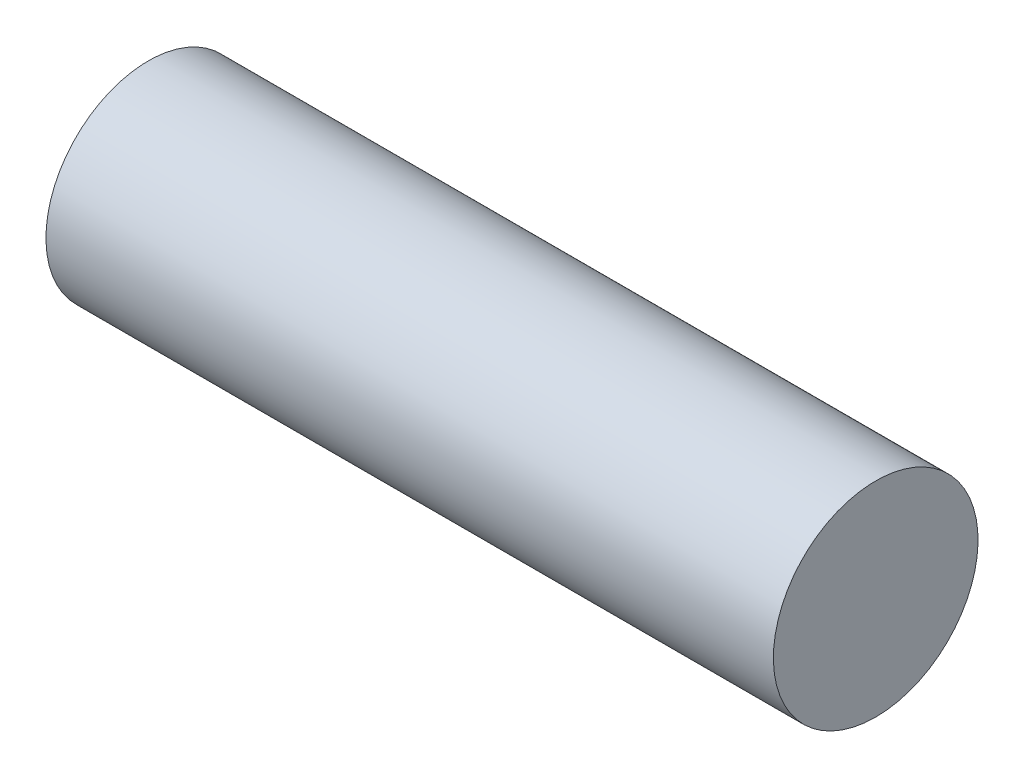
SolidWorks part; units mm, degrees
ref_plane "Front Plane" through (0, 0, 0) normal (0, 0, 1) x (1, 0, 0)
ref_plane "Top Plane" through (0, 0, 0) normal (0, 1, 0) x (1, 0, 0)
ref_plane "Right Plane" through (0, 0, 0) normal (1, 0, 0) x (0, 0, -1)
sketch "Sketch1" plane through (0, 0, 0) normal (0, 0, 1) x (1, 0, 0)
  line L0 (0, 0) -> (0, 8.128)
  line L1 (0, 8.128) -> (57.785, 8.128)
  line L2 (57.785, 8.128) -> (57.785, 0)
  line L3 (57.785, 0) -> (0, 0)
  line L4 (57.785, 0) -> (0, 0) construction
  dimension "D1" = 8.128
  dimension "D2" = 57.785
revolve "Revolve1" add sketch "Sketch1" angle 360 about L4
